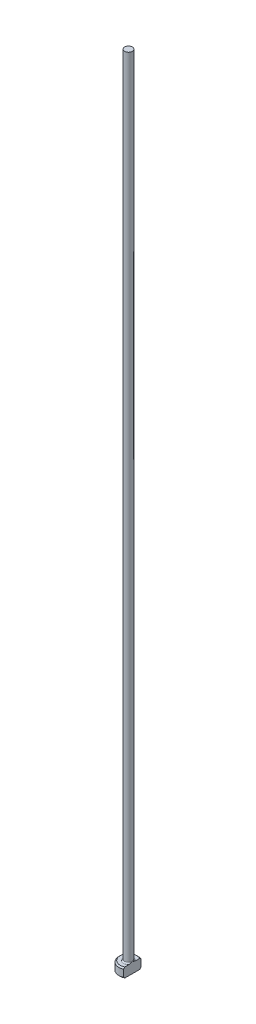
SolidWorks part; units mm, degrees
ref_plane "Front Plane" through (0, 0, 0) normal (0, 0, 1) x (1, 0, 0)
ref_plane "Top Plane" through (0, 0, 0) normal (0, 1, 0) x (1, 0, 0)
ref_plane "Right Plane" through (0, 0, 0) normal (1, 0, 0) x (0, 0, -1)
sketch "Sketch1" plane through (0, 0, 0) normal (0, 0, 1) x (1, 0, 0)
  line L0 (0, 259.9588) -> (0, -15.1925) construction
  line L1 (0, 0) -> (-1.5, 0)
  line L2 (-1.5, 0) -> (-1.5, 1.5)
  line L3 (-1.5, 1.5) -> (-0.6, 1.5)
  line L4 (-0.6, 1.5) -> (-0.6, 125)
  line L5 (-0.6, 125) -> (0, 125)
  line L6 (0, 125) -> (0, 0)
  dimension "L" = 125
  dimension "H" = 3
  dimension "T" = 1.5
  dimension "D" = 1.2
revolve "Revolve1" add sketch "Sketch1" angle 360 about L0
chamfer "Chamfer1" distance 0.2 angle 45 2 edges at (0, 1.5, 1.5) (0, 0, 1.5)
fillet "Fillet1" radius 0.2 1 edges at (0, 1.5, 0.6)
sketch "Sketch2" plane through (0, 0, 0) normal (0, 1, 0) x (1, 0, 0)
  line L0 (0.6, 1.3748) -> (0.6, -1.3748)
  circle A0 centre (0, 0) radius 1.5 construction
  arc A1 (0.6, -1.3748) -> (0.6, 1.3748) centre (0, 0) ccw
  circle A2 centre (0, 0) radius 0.6 construction
extrude "KEY" cut sketch "Sketch2" along normal through all
